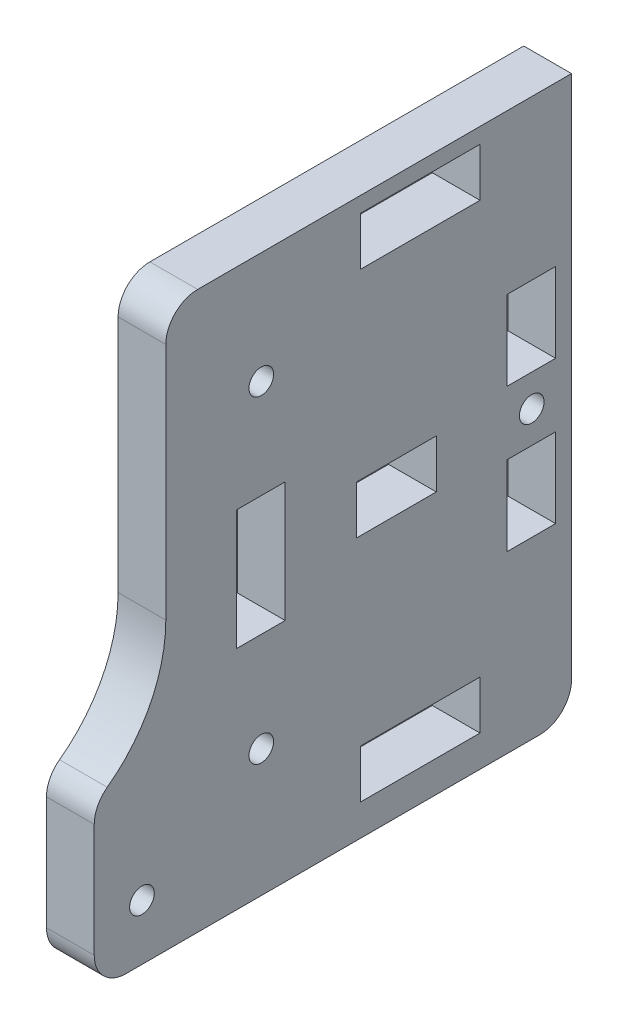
SolidWorks part; units mm, degrees
ref_plane "Спереди" through (0, 0, 0) normal (0, 0, 1) x (1, 0, 0)
ref_plane "Сверху" through (0, 0, 0) normal (0, 1, 0) x (1, 0, 0)
ref_plane "Справа" through (0, 0, 0) normal (1, 0, 0) x (0, 0, -1)
sketch "Эскиз1" plane through (0, 0, 0) normal (1, 0, 0) x (0, 0, -1)
  line L0 (0, 139.2616) -> (0, 0) construction
  line L1 (0, 0) -> (-330.0907, 0) construction
  line L2 (0, 0) -> (-60, 0)
  line L3 (-60, 20.4115) -> (-60, 0)
  line L5 (-51, 36) -> (-51, 70)
  line L6 (-51, 70) -> (0, 70)
  line L7 (0, 70) -> (0, 0)
  arc A0 (-60, 20.4115) -> (-51, 36) centre (-69, 36) ccw
  dimension "D3" = 18
  dimension "D2" = 70
  dimension "D4" = 36
  dimension "D5" = 60
  dimension "D10" = 51
extrude "Бобышка-Вытянуть1" add sketch "Эскиз1" along normal blind 6
fillet "Скругление1" radius 4 4 edges at (3, 70, 51) (3, 0, 0) (3, 0, 60) (3, 20.4115, 60)
sketch "Эскиз2" plane through (6, 0, 0) normal (1, 0, 0) x (0, 0, -1)
  line L0 (-67.1297, 7) -> (0, 7) construction
  line L2 (0, 4) -> (0, 70) construction
  line L3 (-5, 0) -> (-5, 70) construction
  line L4 (-56, 0) -> (-4, 0) construction
  line L5 (0, 70) -> (-47, 70) construction
  line L6 (0, 36) -> (-38.9899, 36) construction
  line L8 (-39, 70) -> (-39, 0) construction
  line L10 (-56, 0) -> (-4, 0) construction
  circle A0 centre (-39, 16) radius 1.55
  circle A1 centre (-5, 36) radius 1.55
  circle A5 centre (-54, 7) radius 1.55
  circle A6 centre (-39, 56) radius 1.55
  dimension "D2" = 3.1
  dimension "D3" = 40
  dimension "D4" = 54
  dimension "D5" = 7
  dimension "D1" = 5
  dimension "D8" = 34
  dimension "D10" = 34
extrude "Вырез-Вытянуть1" cut sketch "Эскиз2" against normal through all
sketch "Эскиз3" plane through (6, 0, 0) normal (1, 0, 0) x (0, 0, -1)
  line L0 (0, 36) -> (-50.727, 36) construction
  line L1 (0, 4) -> (0, 70) construction
  line L2 (0, 70) -> (-47, 70) construction
  line L3 (-2, 22) -> (-2, 32)
  line L4 (-8.1, 50) -> (-2, 50)
  line L5 (-8.1, 50) -> (-8.1, 40)
  line L6 (-8.1, 40) -> (-2, 40)
  line L8 (-2, 50) -> (-2, 40)
  line L9 (-42.1, 43.55) -> (-36, 43.55)
  line L10 (-42.1, 43.55) -> (-42.1, 28.45)
  line L11 (-42.1, 28.45) -> (-36, 28.45)
  line L12 (-36, 43.55) -> (-36, 28.45)
  line L13 (-27, 39.05) -> (-17, 39.05)
  line L14 (-27, 39.05) -> (-27, 32.95)
  line L15 (-27, 32.95) -> (-17, 32.95)
  line L16 (-17, 39.05) -> (-17, 32.95)
  line L17 (-27, 39.05) -> (-17, 32.95) construction
  line L18 (-27, 32.95) -> (-17, 39.05) construction
  line L19 (-8.1, 32) -> (-2, 32)
  line L20 (-8.1, 22) -> (-8.1, 32)
  line L21 (-8.1, 22) -> (-2, 22)
  line L22 (0, 70) -> (-47, 70) construction
  line L23 (-26.5, 68.05) -> (-11.5, 68.05)
  line L24 (-26.5, 68.05) -> (-26.5, 61.95)
  line L25 (-26.5, 61.95) -> (-11.5, 61.95)
  line L26 (-11.5, 68.05) -> (-11.5, 61.95)
  line L27 (-26.5, 68.05) -> (-11.5, 61.95) construction
  line L28 (-26.5, 61.95) -> (-11.5, 68.05) construction
  line L29 (-26.5, 10.05) -> (-11.5, 3.95) construction
  line L30 (-26.5, 3.95) -> (-11.5, 10.05) construction
  line L31 (-11.5, 3.95) -> (-11.5, 10.05)
  line L32 (-26.5, 10.05) -> (-11.5, 10.05)
  line L33 (-26.5, 3.95) -> (-26.5, 10.05)
  line L34 (-26.5, 3.95) -> (-11.5, 3.95)
  point P4 (-42.1, 36)
  point P15 (-22, 36)
  point P24 (-19, 65)
  point P35 (-19, 7)
  dimension "D1" = 22
  dimension "D2" = 14
  dimension "D3" = 34
  dimension "D4" = 6.1
  dimension "D5" = 15.1
  dimension "D6" = 2
  dimension "D7" = 10
  dimension "D8" = 6.1
  dimension "D9" = 8
  dimension "D10" = 5
  dimension "D11" = 6.1
  dimension "D12" = 15
  dimension "D13" = 19
extrude "Вырез-Вытянуть2" cut sketch "Эскиз3" against normal through all
